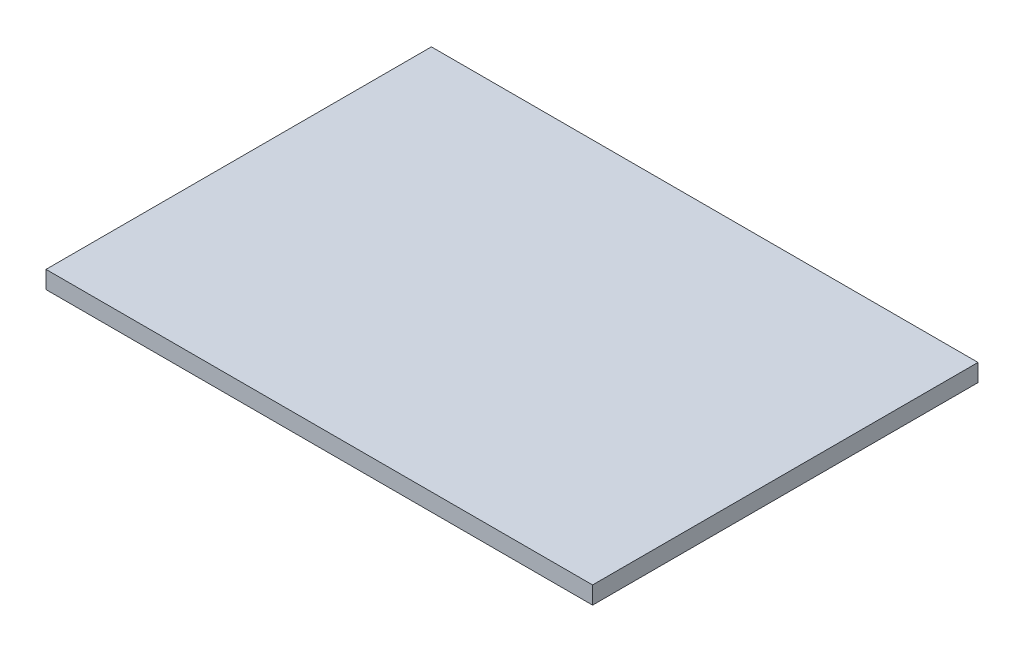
SolidWorks part; units mm, degrees
ref_plane "Plan de face" through (0, 0, 0) normal (0, 0, 1) x (1, 0, 0)
ref_plane "Plan de dessus" through (0, 0, 0) normal (0, 1, 0) x (1, 0, 0)
ref_plane "Plan de droite" through (0, 0, 0) normal (1, 0, 0) x (0, 0, -1)
sketch "Esquisse1" plane through (0, 0, 0) normal (0, 0, 1) x (1, 0, 0)
  line L1 (205.8447, 39.1997) -> (-106.1553, 39.1997)
  line L2 (205.8447, 39.1997) -> (205.8447, 49.1997)
  line L3 (205.8447, 49.1997) -> (-106.1553, 49.1997)
  line L4 (-106.1553, 39.1997) -> (-106.1553, 49.1997)
  dimension "D1" = 10
  dimension "D2" = 312
extrude "Boss.-Extru.1" add sketch "Esquisse1" along normal blind 220
